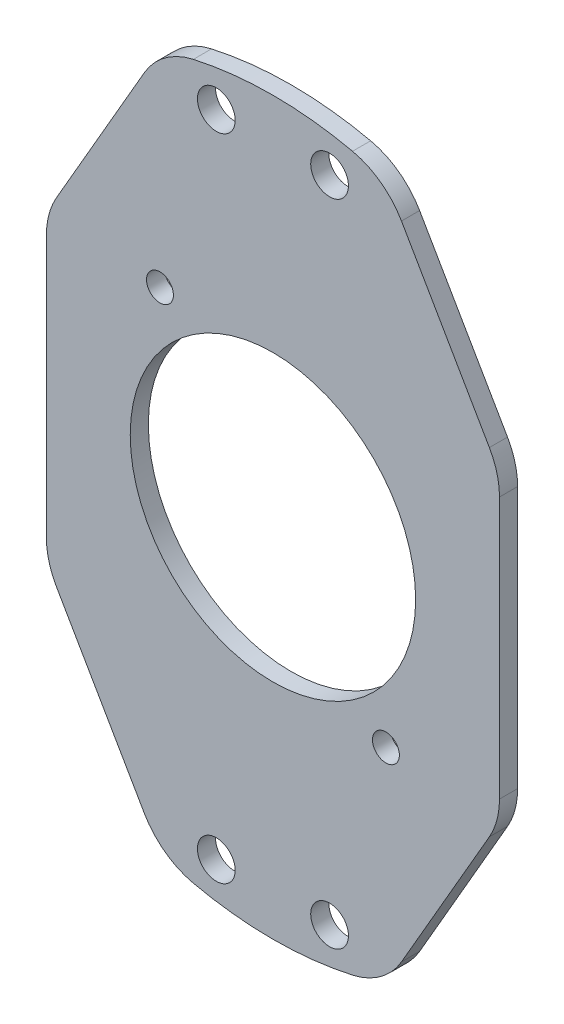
SolidWorks part; units mm, degrees
ref_plane "Front Plane" through (0, 0, 0) normal (0, 0, 1) x (1, 0, 0)
ref_plane "Top Plane" through (0, 0, 0) normal (0, 1, 0) x (1, 0, 0)
ref_plane "Right Plane" through (0, 0, 0) normal (1, 0, 0) x (0, 0, -1)
sketch "Sketch1" plane through (0, 0, 0) normal (0, 0, 1) x (1, 0, 0)
  line L0 (0, 19.5313) -> (0, 0) construction
  line L1 (-6.35, 31.75) -> (6.35, 31.75) construction
  line L2 (-19.05, 23.7459) -> (-19.05, -23.7459)
  line L3 (-6.35, -31.75) -> (6.35, -31.75) construction
  line L4 (19.05, 23.7459) -> (19.05, -23.7459)
  line L5 (-19.05, 31.75) -> (19.05, -31.75) construction
  line L6 (-19.05, -31.75) -> (19.05, 31.75) construction
  line L7 (0, 0) -> (17.8312, 0) construction
  circle A0 centre (-4.7625, 27.305) radius 1.5875
  circle A1 centre (4.7625, 27.305) radius 1.5875
  circle A2 centre (4.7625, -27.305) radius 1.5875
  circle A3 centre (-4.7625, -27.305) radius 1.5875
  circle A8 centre (0, 0) radius 12
  arc A9 (18.7529, 24.3497) -> (-18.7529, 24.3497) centre (0, 0) ccw
  arc A10 (-18.7529, -24.3497) -> (18.7529, -24.3497) centre (0, 0) ccw
  arc A11 (-19.05, 23.7459) -> (-18.7529, 24.3497) centre (-18.288, 23.7459) cw
  arc A12 (19.05, 23.7459) -> (18.7529, 24.3497) centre (18.288, 23.7459) ccw
  arc A13 (19.05, -23.7459) -> (18.7529, -24.3497) centre (18.288, -23.7459) cw
  arc A14 (-18.7529, -24.3497) -> (-19.05, -23.7459) centre (-18.288, -23.7459) cw
  point P4 (0, 0)
  dimension "D1" = 9.525
  dimension "D2" = 54.61
  dimension "D5" = 3.175
  dimension "D6" = 30.734
  dimension "D7" = 24
  dimension "D8" = 0.762
  dimension "D3" = 38.1
  dimension "D4" = 63.5
extrude "Boss-Extrude1" add sketch "Sketch1" along normal blind 1.524
hole_wizard "#4-40 Tapped Hole1" positions "Sketch2" profile "Sketch3" tap size "#4-40" standard "ANSI Inch"
sketch "Sketch2" plane through (0, 0, 1.524) normal (0, 0, 1) x (1, 0, 0)
  point P0 (-9.4996, 11.9888)
  point P3 (9.4996, -12.0142)
sketch "Sketch3" plane through (-9.4996, 11.9888, 1.524) normal (1, 0, 0) x (0, -1, 0)
  line L0 (0, 0) -> (0, 1.524)
  line L1 (0, 1.524) -> (1.1303, 1.524)
  line L2 (1.1303, 1.524) -> (1.1303, 0)
  line L5 (1.1303, 0) -> (0, 0)
  line L11 (0, -6.35) -> (0, 107.95) construction
  dimension "Thru Tap Drill Dia." = 2.2606
  dimension "Thru Tap Drill Depth" = 1.524
sketch "Sketch4" plane through (0, 0, 0) normal (0, 0, -1) x (-1, 0, 0)
  line L1 (-13.97, 7.62) -> (-4.3868, 7.62)
  line L2 (-13.97, 7.62) -> (-13.97, -7.62)
  line L3 (-13.97, -7.62) -> (-4.3868, -7.62)
  line L4 (-4.3868, 7.62) -> (-4.3868, -7.62)
  line L5 (-13.97, 7.62) -> (-4.3868, -7.62) construction
  line L6 (-13.97, -7.62) -> (-4.3868, 7.62) construction
  circle A0 centre (0, 0) radius 12 construction
  point P4 (-9.1784, 0)
  dimension "D1" = 13.97
  dimension "D2" = 15.24
extrude "Cut-Extrude1" [suppressed] cut sketch "Sketch4" against normal through all
sketch "Sketch5" plane through (0, 0, 1.524) normal (0, 0, 1) x (1, 0, 0)
  line L0 (0, 36.7819) -> (0, 0) construction
  line L1 (0, 0) -> (39.0575, 0) construction
  line L2 (7.1412, 33.3266) -> (19.05, 12.7)
  line L3 (19.05, -23.7459) -> (19.05, 23.7459) construction
  line L4 (19.05, 12.7) -> (19.05, 33.3266)
  line L5 (19.05, 33.3266) -> (7.1412, 33.3266)
  line L6 (-19.05, 33.3266) -> (-7.1412, 33.3266)
  line L7 (-19.05, 12.7) -> (-19.05, 33.3266)
  line L8 (-7.1412, 33.3266) -> (-19.05, 12.7)
  line L9 (-7.1412, -33.3266) -> (-19.05, -12.7)
  line L10 (-19.05, -12.7) -> (-19.05, -33.3266)
  line L11 (-19.05, -33.3266) -> (-7.1412, -33.3266)
  line L12 (19.05, -33.3266) -> (7.1412, -33.3266)
  line L13 (19.05, -12.7) -> (19.05, -33.3266)
  line L14 (7.1412, -33.3266) -> (19.05, -12.7)
  circle A0 centre (0, 0) radius 19.05 construction
  dimension "D1" = 25.4
  dimension "D2" = 30
extrude "Cut-Extrude2" cut sketch "Sketch5" against normal through all
fillet "Fillet1" radius 6.35 8 edges at (19.05, -12.7, 0.762) (19.05, 12.7, 0.762) (9.5087, 29.2261, 0.762) (-19.05, 12.7, 0.762) (-19.05, -12.7, 0.762) (-9.5087, -29.2261, 0.762) (9.5087, -29.2261, 0.762) (-9.5087, 29.2261, 0.762)
